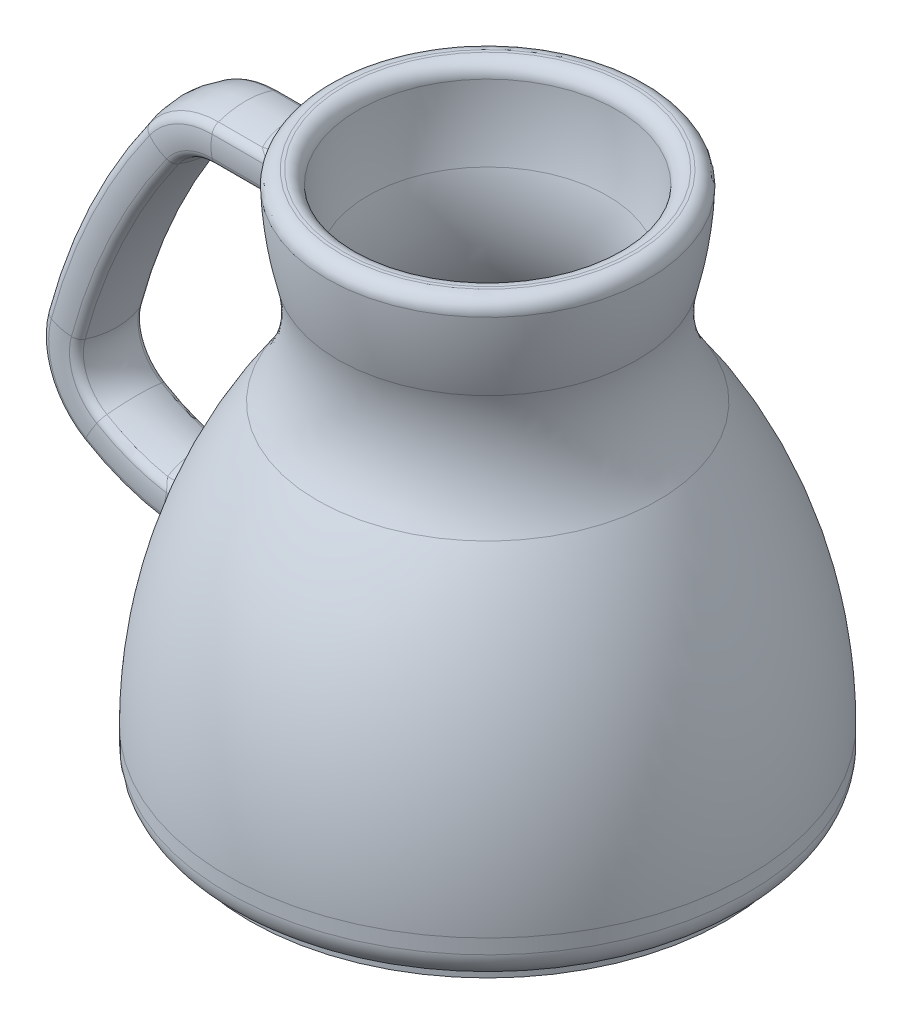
SolidWorks part; units mm, degrees
ref_plane "Front" through (0, 0, 0) normal (0, 0, 1) x (1, 0, 0)
ref_plane "Top" through (0, 0, 0) normal (0, 1, 0) x (1, 0, 0)
ref_plane "Right" through (0, 0, 0) normal (1, 0, 0) x (0, 0, -1)
sketch "Sketch1" plane through (0, 0, 0) normal (0, 0, 1) x (1, 0, 0)
  line L0 (0, 0) -> (0, 136.1051) construction
  line L1 (53.975, 1.905) -> (53.975, 0)
  line L2 (0, 0) -> (53.975, 0)
  line L3 (59.055, 11.43) -> (59.055, 8.1267)
  line L5 (0, 0) -> (0, 120.65)
  line L6 (0, 120.65) -> (36.5125, 120.65)
  arc A0 (36.5125, 120.65) -> (33.9578, 100.2128) centre (-46.5138, 120.65) cw
  arc A1 (33.9578, 100.2128) -> (38.6925, 75.0007) centre (63.5, 92.71) ccw
  arc A2 (38.6925, 75.0007) -> (59.055, 11.43) centre (-50.3586, 11.43) cw
  arc A3 (53.975, 1.905) -> (59.055, 8.1267) centre (52.705, 8.1267) ccw
  dimension "D5" = 66.04
  dimension "D7" = 92.71
  dimension "D9" = 6.35
  dimension "D6" = 30.48
  dimension "D1" = 120.65
  dimension "D2" = 73.025
  dimension "D3" = 118.11
  dimension "D4" = 11.43
  dimension "D10" = 107.95
  dimension "D11" = 1.905
revolve "Base-Revolve" add sketch "Sketch1" angle 360 about L0
sketch "Sketch3" plane through (0, 0, 0) normal (0, 0, 1) x (1, 0, 0)
  line L0 (0, 101.6) -> (-54.8655, 101.6)
  line L1 (0, 0) -> (0, 136.1051) construction
  line L2 (-58.1595, 25.4) -> (0, 25.4)
  line L3 (36.5125, 120.65) -> (-36.5125, 120.65) construction
  arc A1 (-82.2357, 32.0606) -> (-58.1595, 25.4) centre (-58.1595, 72.2449) ccw
  arc A2 (-38.6925, 75.0007) -> (-59.055, 11.43) centre (50.3586, 11.43) ccw construction
  arc A3 (-67.1178, 95.2926) -> (-54.8655, 101.6) centre (-54.8655, 86.5461) cw
  arc A4 (-82.2357, 32.0606) -> (-89.037, 48.8799) centre (-74.4986, 44.9741) cw
  arc A7 (-67.1178, 95.2926) -> (-93.98, 11.43) centre (50.3586, 11.43) ccw
  arc A8 (-67.1178, 95.2926) -> (-89.037, 48.8799) centre (50.3586, 11.43) ccw
  dimension "D1" = 46.8449
  dimension "D4" = 34.925
  dimension "D2" = 76.2
  dimension "D3" = 19.05
sketch "Sketch4" plane through (0, 0, 0) normal (1, 0, 0) x (0, 0, -1)
  line L0 (-17.3168, 25.4) -> (17.3168, 25.4) construction
  line L1 (0, -22.1505) -> (0, 72.9505) construction
  arc A0 (-6.192, 29.4456) -> (6.192, 29.4456) centre (0, 11.43) cw
  arc A1 (-6.192, 21.3544) -> (6.192, 21.3544) centre (0, 39.37) ccw
  arc A2 (7.6535, 27.7561) -> (7.6535, 23.0439) centre (-4.826, 25.4) cw
  arc A3 (-7.6535, 27.7561) -> (-7.6535, 23.0439) centre (4.826, 25.4) ccw
  arc A4 (-7.6535, 23.0439) -> (-6.192, 21.3544) centre (-5.4696, 23.4562) ccw
  arc A5 (-7.6535, 27.7561) -> (-6.192, 29.4456) centre (-5.4696, 27.3438) cw
  arc A6 (7.6535, 27.7561) -> (6.192, 29.4456) centre (5.4696, 27.3438) ccw
  arc A7 (7.6535, 23.0439) -> (6.192, 21.3544) centre (5.4696, 23.4562) cw
  point P5 (0, 25.4)
  point P17 (-7.3518, 21.7958)
  point P20 (-7.3518, 29.0042)
  point P23 (7.3518, 29.0042)
  point P26 (7.3518, 21.7958)
  dimension "D1" = 15.748
  dimension "D2" = 10.16
  dimension "D3" = 19.05
  dimension "D4" = 12.7
  dimension "D5" = 2.2225
sweep "Boss-Sweep1" add profiles "Sketch4" path "Sketch3"
fillet "Fillet1" radius 9.525 33 edges at (-58.0413, 22.3381, -7.3904) (-57.239, 28.5512, -7.3355) (-57.3838, 30.4799, -0.0531) (-57.2137, 29.0224, 6.9262) (-58.0433, 22.3267, 7.3837) (-58.692, 20.3253, 0.3144) (-32.7532, 98.4375, -7.3282) (-33.2579, 96.5227, 0.3215) (-32.7521, 98.0168, 6.9702) (-34.3982, 105.2743, 6.8642) (-35.3097, 106.6532, -1.0108) (-34.1737, 104.6779, -7.381) (-58.1595, 22.3326, 7.3871) (-58.0465, 23.0439, 7.6535) (-58.1595, 25.4, 7.874) (-57.7404, 27.7561, 7.6535) (-58.1595, 28.7978, 7.1505) (-57.6935, 29.4456, 6.192) (-58.1595, 30.48, 0) (-57.6935, 29.4456, -6.192) (-58.1595, 28.7978, -7.1505) (-57.7404, 27.7561, -7.6535) (-58.1595, 25.4, -7.874) (-58.0465, 23.0439, -7.6535) (-58.1595, 22.3326, -7.3871)
sketch "Sketch2" plane through (0, 0, 0) normal (0, 0, 1) x (1, 0, 0)
  line L0 (29.464, 120.65) -> (0, 120.65)
  line L1 (0, 120.65) -> (0, 7.0485)
  line L2 (-53.975, 7.0485) -> (53.975, 7.0485)
  line L3 (0, 7.0485) -> (47.625, 7.0485)
  line L4 (0, -6.3265) -> (0, 132.4089) construction
  line L5 (0, 0) -> (0, 136.1051) construction
  arc A6 (47.625, 7.0485) -> (52.0065, 11.43) centre (47.625, 11.43) ccw
  arc A9 (52.0065, 11.43) -> (32.9558, 70.9055) centre (-50.3586, 11.43) ccw
  arc A10 (27.1262, 101.9478) -> (32.9558, 70.9055) centre (63.5, 92.71) ccw
  arc A11 (27.1262, 101.9478) -> (29.464, 120.65) centre (-46.5138, 120.65) ccw
  arc A12 (52.0065, 11.43) -> (32.9558, 70.9055) centre (-50.3586, 11.43) ccw
  arc A13 (27.1262, 101.9478) -> (32.9558, 70.9055) centre (63.5, 92.71) ccw
  arc A14 (27.1262, 101.9478) -> (29.464, 120.65) centre (-46.5138, 120.65) ccw
  dimension "D1" = 7.0485
  dimension "D2" = 7.0485
revolve "Cut-Revolve1" cut sketch "Sketch2" angle 360 about L4
fillet "Fillet2" radius 3.175 2 edges at (29.464, 120.65, 0) (0, 120.65, -36.5125)
